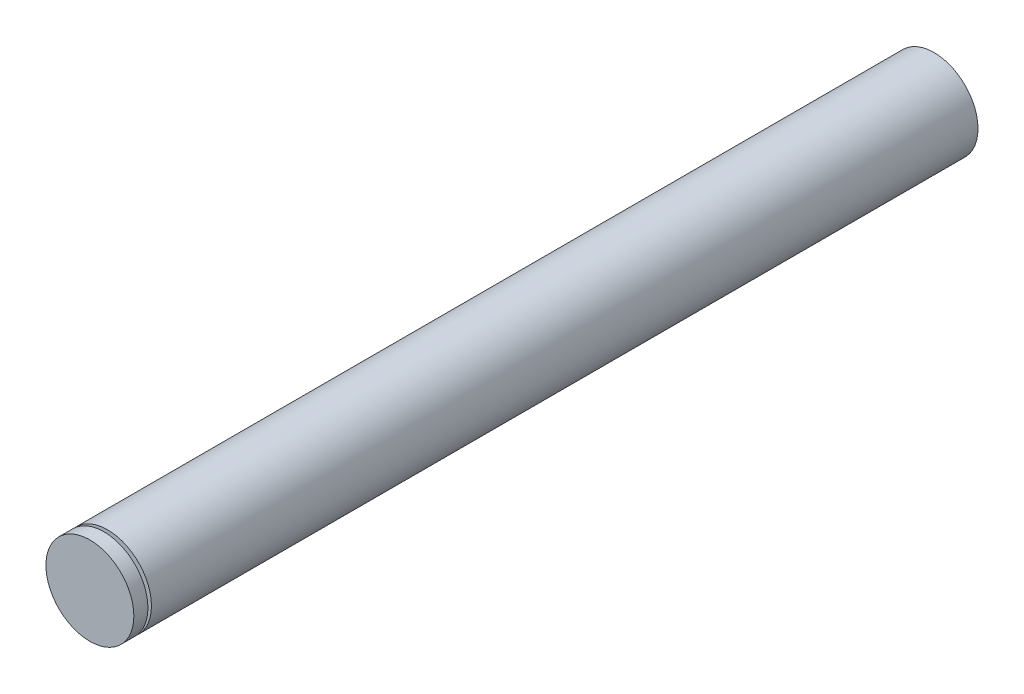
SolidWorks part; units mm, degrees
ref_plane "Plan de face" through (0, 0, 0) normal (0, 0, 1) x (1, 0, 0)
ref_plane "Plan de dessus" through (0, 0, 0) normal (0, 1, 0) x (1, 0, 0)
ref_plane "Plan de droite" through (0, 0, 0) normal (1, 0, 0) x (0, 0, -1)
sketch "Esquisse1" plane through (0, 0, 0) normal (0, 0, 1) x (1, 0, 0)
  circle A0 centre (0, 0) radius 25
  dimension "D1" = 50
extrude "Boss.-Extru.1" add sketch "Esquisse1" along normal blind 480
sketch "Esquisse2" plane through (0, 0, 0) normal (1, 0, 0) x (0, 0, -1)
  line L0 (0, 25) -> (-480, 25) construction
  line L1 (-472, 25) -> (-470, 25)
  line L2 (-472, 25) -> (-472, 18)
  line L3 (-472, 18) -> (-470, 18)
  line L4 (-470, 25) -> (-470, 18)
  line L5 (-480, 25) -> (-480, -25) construction
  line L6 (-480, 0) -> (19.6023, 0) construction
  dimension "D1" = 10
  dimension "D2" = 8
  dimension "D3" = 7
revolve "Enlèvement de matière-Révolution1" cut sketch "Esquisse2" angle 360 about L6
